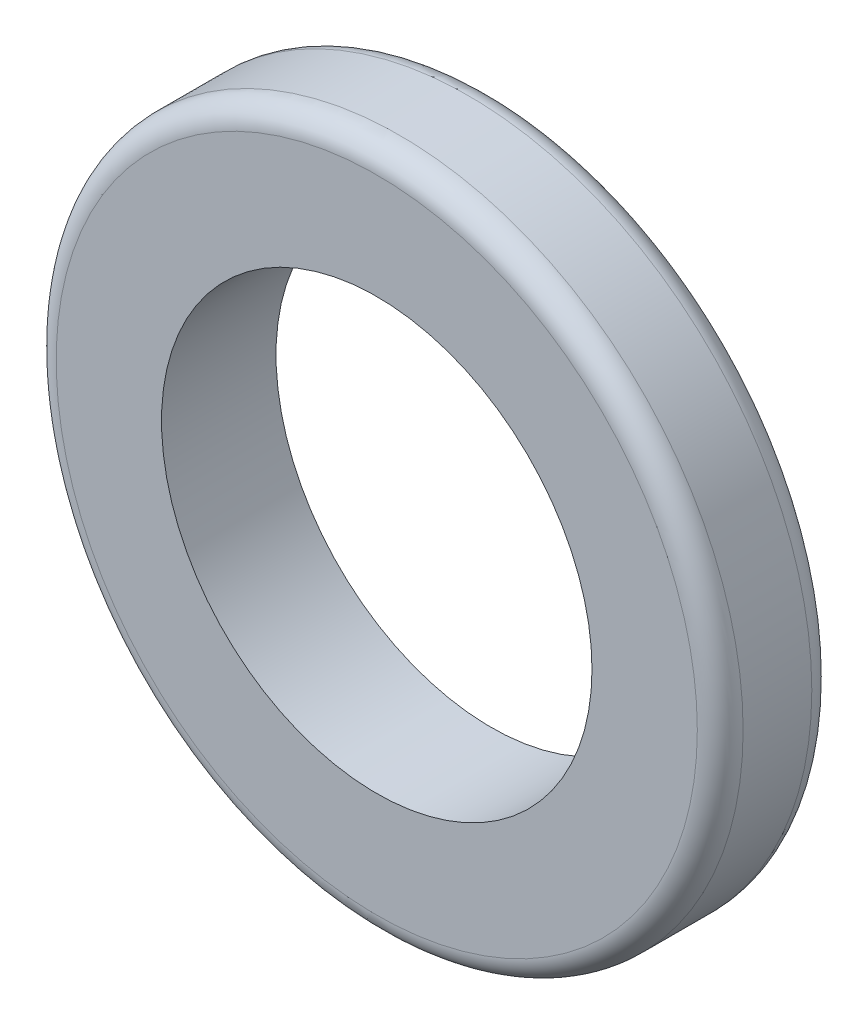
SolidWorks part; units mm, degrees
ref_plane "Front Plane" through (0, 0, 0) normal (0, 0, 1) x (1, 0, 0)
ref_plane "Top Plane" through (0, 0, 0) normal (0, 1, 0) x (1, 0, 0)
ref_plane "Right Plane" through (0, 0, 0) normal (1, 0, 0) x (0, 0, -1)
sketch "Sketch1" plane through (0, 0, 0) normal (0, 0, 1) x (1, 0, 0)
  circle A0 centre (0, 0) radius 23.876
  circle A1 centre (0, 0) radius 38.1
  dimension "D1" = 47.752
  dimension "D2" = 76.2
extrude "Boss-Extrude1" add sketch "Sketch1" along normal blind 12.7
fillet "Fillet1" radius 2.54 2 edges at (38.1, 0, 0) (38.1, 0, 12.7)
